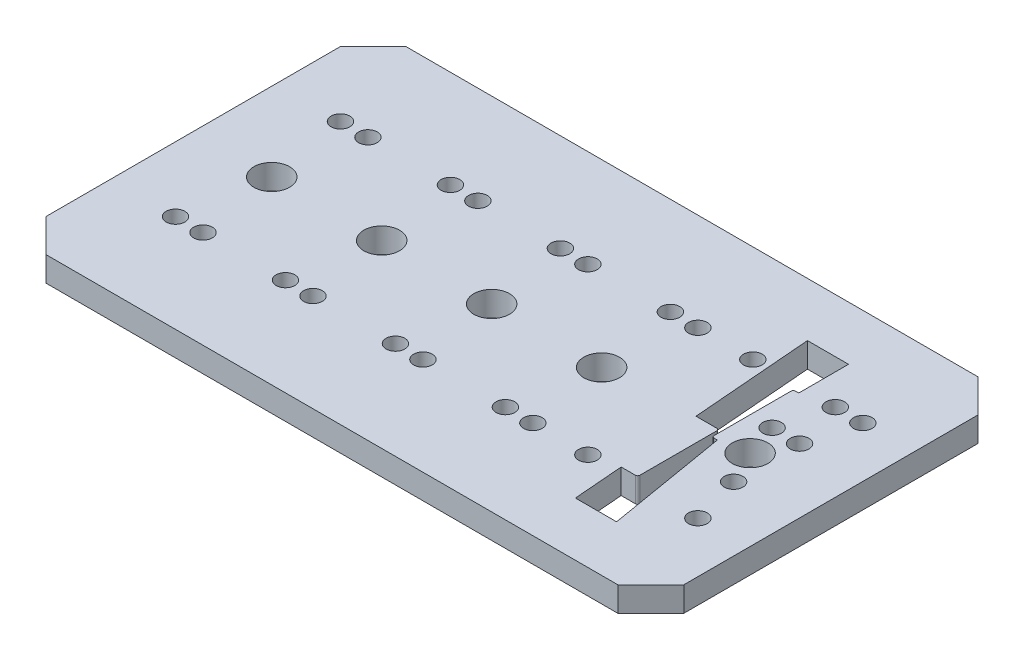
SolidWorks part; units mm, degrees
ref_plane "Front Plane" through (0, 0, 0) normal (0, 0, 1) x (1, 0, 0)
ref_plane "Top Plane" through (0, 0, 0) normal (0, 1, 0) x (1, 0, 0)
ref_plane "Right Plane" through (0, 0, 0) normal (1, 0, 0) x (0, 0, -1)
sketch "Sketch11" plane through (0, 0, 0) normal (0, 1, 0) x (1, 0, 0)
  line L0 (-47, 32.75) -> (-53, 26.75)
  line L1 (41.75, -13.5) -> (41.75, 0.5)
  line L2 (-53, 26.75) -> (-53, -26.75)
  line L3 (43.25, -0.9) -> (46.9663, -22.95)
  line L4 (-53, -26.75) -> (-47, -32.75)
  line L5 (38.7545, -13.9) -> (41.35, -13.9)
  line L7 (41.75, -26.75) -> (41.75, 26.75) construction
  line L8 (-47, -32.75) -> (57, -32.75)
  line L9 (57, -32.75) -> (63, -26.75)
  line L10 (63, -26.75) -> (63, 26.75)
  line L11 (63, 26.75) -> (57, 32.75)
  line L12 (57, 32.75) -> (-47, 32.75)
  line L13 (42.25, -0.5) -> (42.25, 13.5)
  line L14 (42.65, 13.9) -> (43.25, 13.9)
  line L15 (37.5612, 0.9) -> (35.7832, 22.95)
  line L16 (-53, 0) -> (81.9374, 0) construction
  line L17 (46.9663, -22.95) -> (39.4842, -22.95)
  line L18 (39.4842, -22.95) -> (38.7545, -13.9)
  line L19 (35.7832, 22.95) -> (43.25, 22.95)
  line L21 (42.25, -13.5) -> (42.25, 0.5) construction
  line L22 (41.35, 0.9) -> (37.5612, 0.9)
  line L23 (42.65, -0.9) -> (43.25, -0.9)
  line L24 (43.25, 13.9) -> (43.25, 22.95)
  line L26 (41.75, -13.5) -> (41.75, 0.5) construction
  arc A0 (42.65, -0.9) -> (42.25, -0.5) centre (42.65, -0.5) cw
  arc A1 (41.35, 0.9) -> (41.75, 0.5) centre (41.35, 0.5) cw
  circle A2 centre (-38.7, 0) radius 3.25
  arc A3 (41.75, -13.5) -> (41.35, -13.9) centre (41.35, -13.5) cw
  circle A4 centre (-41.2, 15) radius 1.7
  arc A5 (42.65, 13.9) -> (42.25, 13.5) centre (42.65, 13.5) ccw
  circle A6 centre (48.3, 0) radius 3.25
  circle A7 centre (-21.2, 15) radius 1.7
  circle A8 centre (-36.2, 15) radius 1.7
  circle A9 centre (-16.2, 15) radius 1.7
  circle A10 centre (-1.2, 15) radius 1.7
  circle A11 centre (3.8, 15) radius 1.7
  circle A12 centre (18.8, 15) radius 1.7
  circle A13 centre (23.8, 15) radius 1.7
  circle A14 centre (-18.7, 0) radius 3.25
  circle A15 centre (53.8, 15) radius 1.7
  circle A16 centre (33.8, -15) radius 1.7
  circle A17 centre (33.8, 15) radius 1.7
  circle A18 centre (48.8, 15) radius 1.7
  circle A19 centre (53.8, -15) radius 1.7
  circle A20 centre (23.8, -15) radius 1.7
  circle A21 centre (18.8, -15) radius 1.7
  circle A22 centre (3.8, -15) radius 1.7
  circle A23 centre (-1.2, -15) radius 1.7
  circle A24 centre (-16.2, -15) radius 1.7
  circle A25 centre (-36.2, -15) radius 1.7
  circle A26 centre (-21.2, -15) radius 1.7
  circle A27 centre (-41.2, -15) radius 1.7
  circle A28 centre (1.3, 0) radius 3.25
  circle A29 centre (21.3, 0) radius 3.25
  circle A73 centre (46.3, 6) radius 1.7
  circle A77 centre (51.3, 6) radius 1.7
  circle A78 centre (51.3, -6) radius 1.7
  circle A85 centre (63.8, 15) radius 1.7
  circle A86 centre (43.8, 15) radius 1.7
  circle A88 centre (38.8, 15) radius 1.7
  circle A89 centre (58.8, 15) radius 1.7
  point P0 (-53, 32.75)
  point P1 (-53, -32.75)
  dimension "D3" = 21.25
  dimension "D8" = 0.4
  dimension "D7" = 0.4
  dimension "D9" = 0.4
  dimension "D5" = 4
  dimension "D4" = 6
  dimension "D6" = 0.5
extrude "Boss-Extrude4" add sketch "Sketch11" along normal blind 4.5
